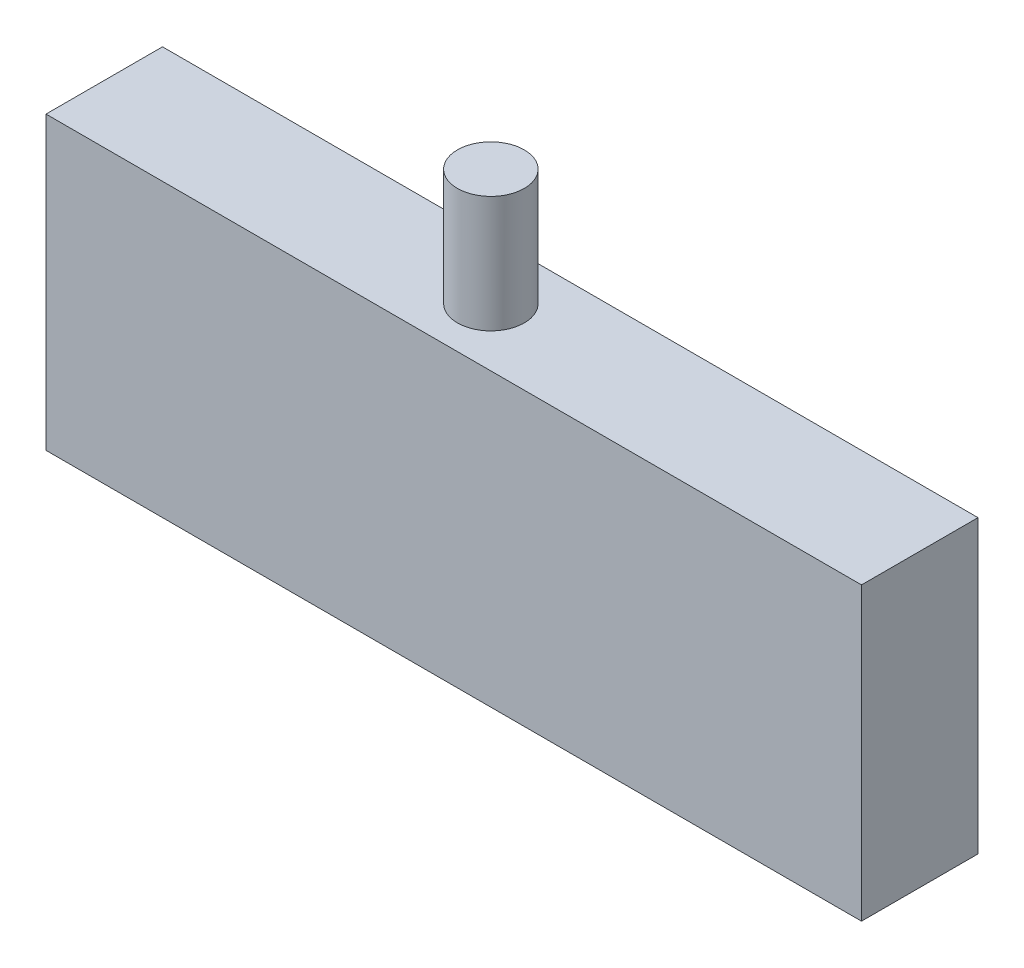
SolidWorks part; units mm, degrees
ref_plane "Front Plane" through (0, 0, 0) normal (0, 0, 1) x (1, 0, 0)
ref_plane "Top Plane" through (0, 0, 0) normal (0, 1, 0) x (1, 0, 0)
ref_plane "Right Plane" through (0, 0, 0) normal (1, 0, 0) x (0, 0, -1)
sketch "Sketch1" plane through (0, 0, 0) normal (0, 0, 1) x (1, 0, 0)
  line L1 (-33.1858, 19.5796) -> (36.8142, 19.5796)
  line L2 (-33.1858, 19.5796) -> (-33.1858, -5.4204)
  line L3 (-33.1858, -5.4204) -> (36.8142, -5.4204)
  line L4 (36.8142, 19.5796) -> (36.8142, -5.4204)
  dimension "D1" = 25
  dimension "D2" = 70
extrude "Boss-Extrude1" add sketch "Sketch1" along normal blind 10
sketch "Sketch2" plane through (0, 19.5796, 0) normal (0, 1, 0) x (1, 0, 0)
  line L0 (36.8142, 0) -> (-33.1858, 0) construction
  circle A0 centre (0, -5) radius 2.8687
  dimension "D1" = 5
extrude "Boss-Extrude2" add sketch "Sketch2" along normal blind 10
